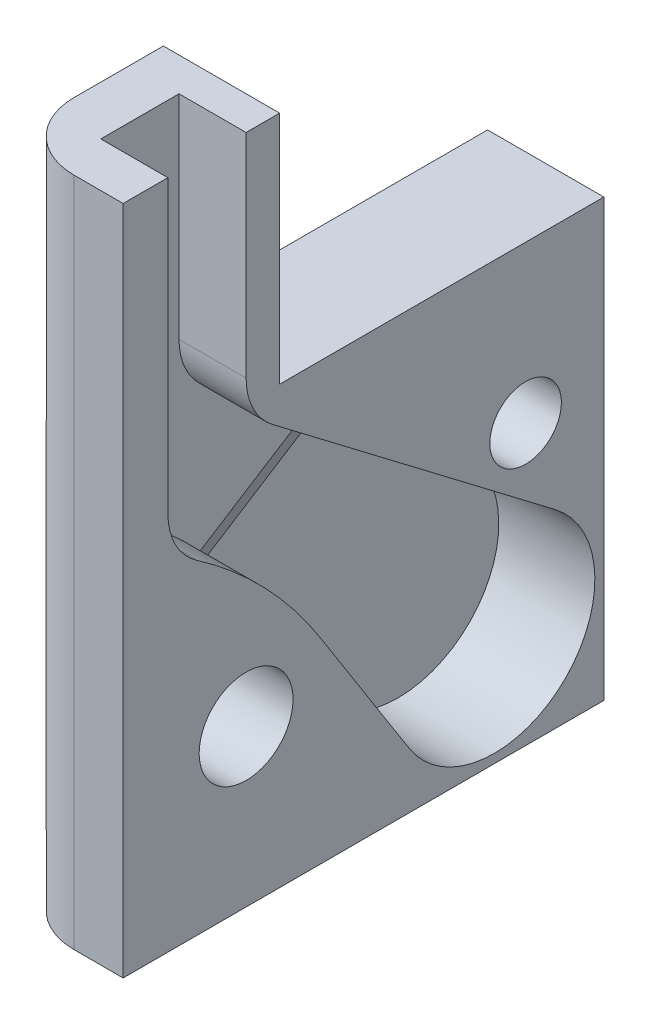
SolidWorks part; units mm, degrees
other "<Protetor do sensor direito 2018>-<Chamfer1>"
ref_plane "Front Plane" through (0, 0, 0) normal (0, 0, 1) x (1, 0, 0)
ref_plane "Top Plane" through (0, 0, 0) normal (0, 1, 0) x (1, 0, 0)
ref_plane "Right Plane" through (0, 0, 0) normal (1, 0, 0) x (0, 0, -1)
mirrored part "Protetor do sensor direito 2018_Mirrored"
